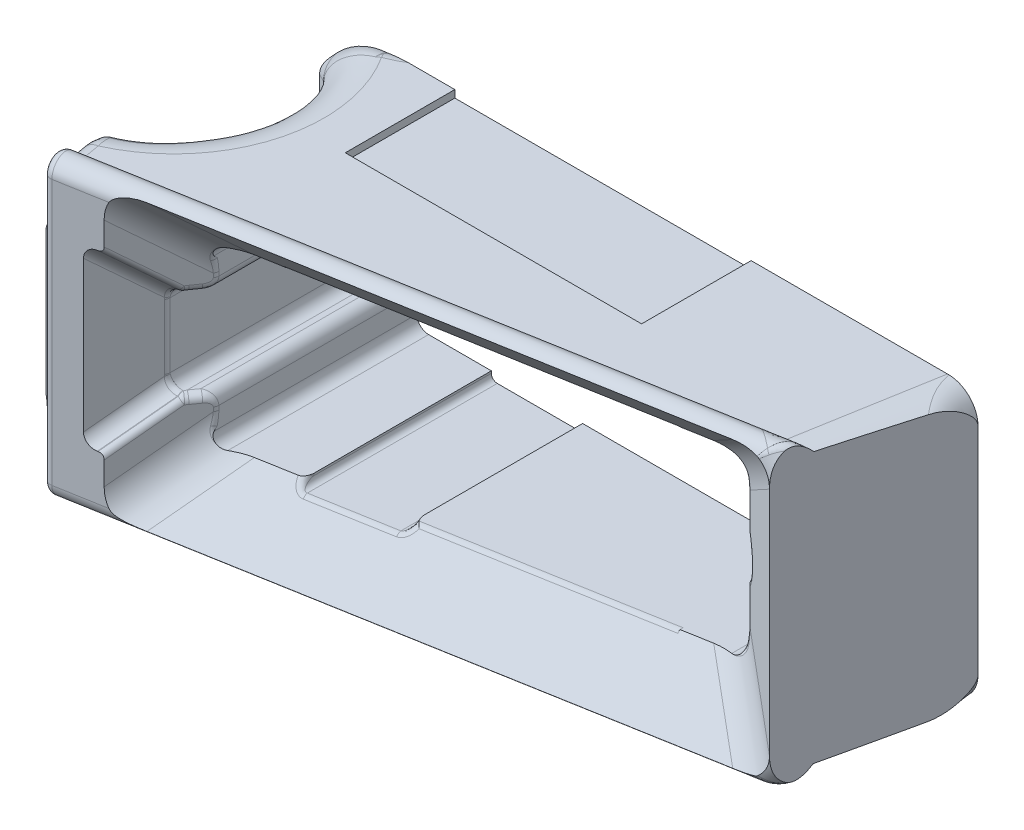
SolidWorks part; units mm, degrees
ref_plane "Front Plane" through (0, 0, 0) normal (0, 0, 1) x (1, 0, 0)
ref_plane "Top Plane" through (0, 0, 0) normal (0, 1, 0) x (1, 0, 0)
ref_plane "Right Plane" through (0, 0, 0) normal (1, 0, 0) x (0, 0, -1)
imported_body "Imported1"
sketch "Sketch2" plane through (0, -76.7261, 0) normal (0, -1, 0) x (1, 0, 0)
  line L0 (167.4019, 8.985) -> (167.4072, 8.9887) construction
  line L1 (167.4019, 8.985) -> (167.4072, 8.9887)
  line L2 (173.0525, -13.5161) -> (167.4072, 8.9887)
  line L3 (167.4072, 8.9887) -> (182.3074, 8.9887)
  line L4 (182.3074, 8.9887) -> (182.3074, -13.5161)
  line L5 (182.3074, -13.5161) -> (173.0525, -13.5161)
extrude "Cut-Extrude2" cut sketch "Sketch2" against normal through all both and the other way through all contours L5 L4 L3 L2
